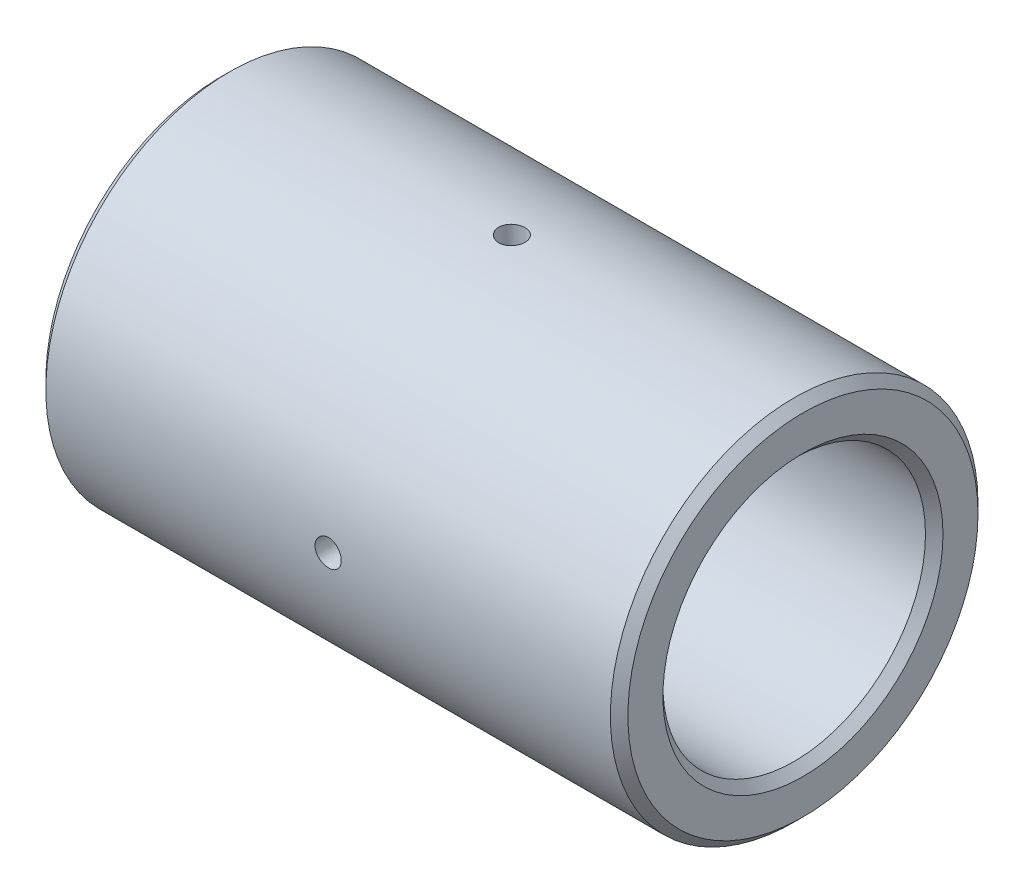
SolidWorks part; units mm, degrees
ref_plane "Front Plane" through (0, 0, 0) normal (0, 0, 1) x (1, 0, 0)
ref_plane "Top Plane" through (0, 0, 0) normal (0, 1, 0) x (1, 0, 0)
ref_plane "Right Plane" through (0, 0, 0) normal (1, 0, 0) x (0, 0, -1)
sketch "Sketch1" plane through (0, 0, 0) normal (0, 0, 1) x (1, 0, 0)
  line L0 (0, 16) -> (0, 20)
  line L1 (1, 21) -> (65.5, 21)
  line L2 (66.5, 20) -> (66.5, 16)
  line L3 (65.5, 15) -> (34.75, 15)
  line L4 (34.75, 15) -> (34.75, 17)
  line L5 (34.75, 17) -> (31.75, 17)
  line L6 (31.75, 17) -> (31.75, 15)
  line L7 (31.75, 15) -> (1, 15)
  line L8 (1, 15) -> (0, 16)
  line L9 (66.5, 16) -> (65.5, 15)
  line L10 (65.5, 21) -> (66.5, 20)
  line L11 (0, 20) -> (1, 21)
  point P0 (0, 15)
  point P1 (0, 21)
  point P3 (66.5, 21)
  point P4 (66.5, 15)
  point P9 (33.25, 17)
  point P18 (33.25, 21)
  dimension "D1" = 15
  dimension "D2" = 21
  dimension "D3" = 17
  dimension "D4" = 3
  dimension "D5" = 33.25
ref_axis "Axis1" through (94.5, 0, 0) along (-1, 0, 0)
revolve "Revolve1" add sketch "Sketch1" angle 360 about axis through (94.5, 0, 0) along (-1, 0, 0)
hole_wizard "Ø3.0mm Dowel Hole1" positions "3DSketch1" profile "Sketch2" hole size "Ø3.0" standard "ISO"
sketch3d "3DSketch1"
  point P0 (33.25, -21, 0)
  point P3 (0, 0, 0)
  point P4 (0, 0, 0)
  point P5 (-120.4333, -21, 0)
  point P6 (0, 0, 0)
  point P7 (0, 0, 0)
  point P8 (30.8402, -21, 0)
  dimension "D1" = 33.25
sketch "Sketch2" plane through (33.25, -21, 0) normal (1, 0, 0) x (0, 0, -1)
  line L0 (0, 0) -> (0, 4)
  line L1 (0, 4) -> (1.5, 4)
  line L2 (1.5, 4) -> (1.5, 0)
  line L5 (1.5, 0) -> (0, 0)
  line L11 (0, -6.35) -> (0, 107.95) construction
  dimension "Thru Hole Dia." = 3
  dimension "Thru Hole Depth" = 4
pattern_circular "CirPattern1" count 4 over 360 about axis through (94.5, 0, 0) along (1, 0, 0) of "Ø3.0mm Dowel Hole1"
